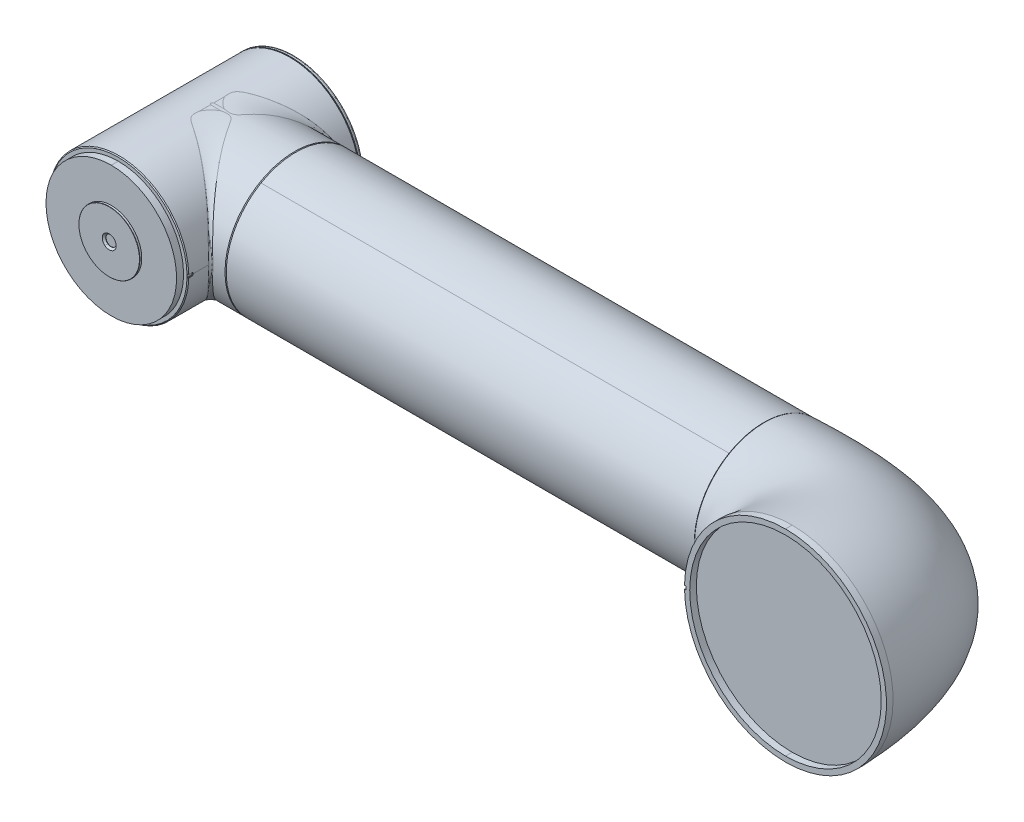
SolidWorks part; units mm, degrees
other "<4.0.07.2008582>-<输入1>"
ref_plane "前视基准面" through (0, 0, 0) normal (0, 0, 1) x (1, 0, 0)
ref_plane "上视基准面" through (0, 0, 0) normal (0, 1, 0) x (1, 0, 0)
ref_plane "右视基准面" through (0, 0, 0) normal (1, 0, 0) x (0, 0, -1)
imported_body "FR5-V6.0-922-4-1-solid1"
imported_body "FR5-V6.0-922-14关节后盖-1-solid1"
sketch "草图1" plane through (0, 0, 61) normal (0, 0, 1) x (1, 0, 0)
  arc A2 (-425, 207) -> (-425, 97) centre (-425, 152) ccw
  arc A3 (-425, 97) -> (-425, 207) centre (-425, 152) ccw
  arc A4 (-425, 207) -> (-425, 97) centre (-425, 152) ccw
  arc A5 (-425, 97) -> (-425, 207) centre (-425, 152) ccw
  dimension "D1" = 0
extrude "凸台-拉伸1" add sketch "草图1" against normal up to surface (20.506 mm away)
other "删除面1"
ref_plane "基准面1" through (0, 152, 0) normal (0, 1, 0) x (1, 0, 0)
other "删除面2"
ref_plane "前视基准面-4.0.07.2008582" through (-794.569, 126.5293, -48.15) normal (-1, 0, 0) x (0, 0, 1)
ref_plane "上视基准面-4.0.07.2008582" through (-794.569, 126.5293, -48.15) normal (0, 1, 0) x (0, 0, 1)
ref_plane "右视基准面-4.0.07.2008582" through (-794.569, 126.5293, -48.15) normal (0, 0, 1) x (1, 0, 0)
inserted part "4.0.07.2008582"
move or copy body "实体-移动/复制2"
pattern_circular "阵列(圆周)1" count 4 over 360 about axis through (-820.01, 152, 0) along (0, 0, 1)
